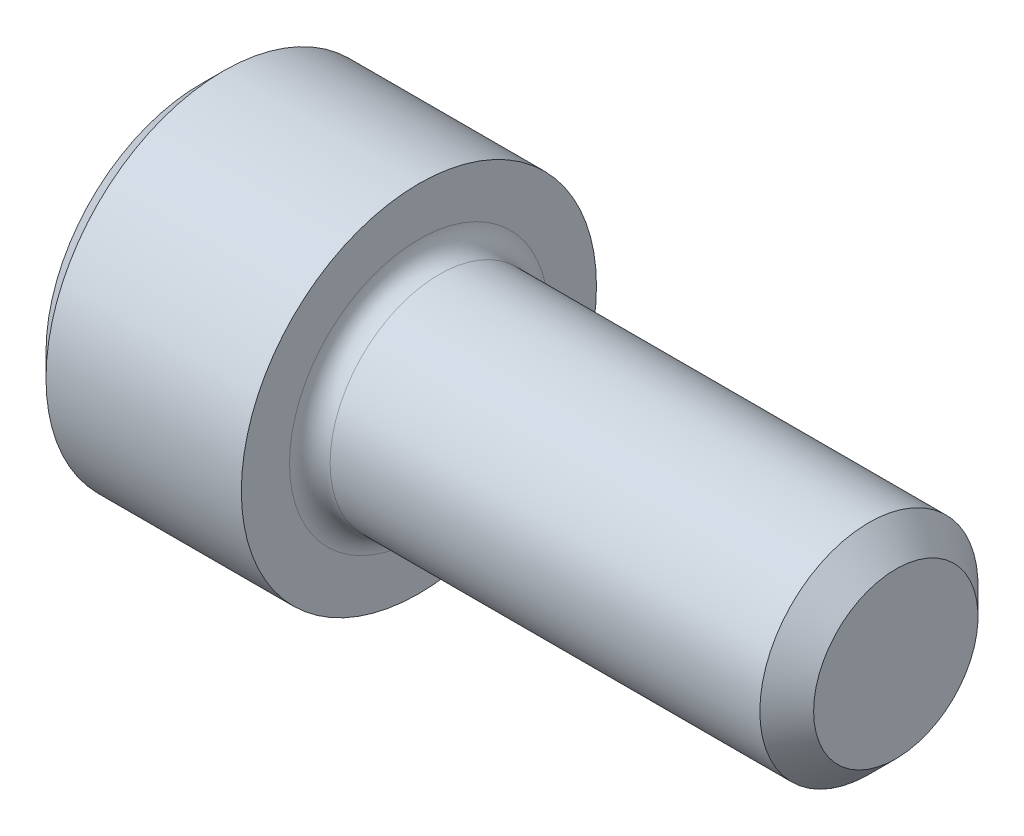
SolidWorks part; units mm, degrees
ref_plane "Plane1" through (0, 0, 0) normal (0, 0, 1) x (1, 0, 0)
ref_plane "Plane2" through (0, 0, 0) normal (0, 1, 0) x (1, 0, 0)
ref_plane "Plane3" through (0, 0, 0) normal (1, 0, 0) x (0, 0, -1)
revolve "Base-Revolve" add sketch "BodySke"
sketch "BodySke" plane through (0, 0, 0) normal (0, 0, 1) x (1, 0, 0)
  line L0 (0, 0) -> (0, 1.5494)
  line L1 (0.2286, 1.778) -> (2.1844, 1.778)
  line L2 (2.1844, 1.778) -> (2.1844, 1.0922)
  line L3 (2.1844, 1.0922) -> (6.6904, 1.0922)
  line L4 (6.9596, 0.823) -> (6.9596, 0)
  line L5 (6.9596, 0) -> (0, 0)
  line L6 (-31.75, 0) -> (127, 0) construction
  line L7 (0, 1.5494) -> (0.2286, 1.778)
  line L8 (6.9596, 0.823) -> (6.6904, 1.0922)
  line L9 (0, -1.5494) -> (0.2286, -1.778) construction
  line L10 (6.9596, -0.823) -> (6.6904, -1.0922) construction
  line L11 (2.6391, 9.525) -> (2.6391, 3.175) construction
  line L12 (2.1844, 9.525) -> (2.1844, 3.175) construction
  line L13 (-31.1404, 9.525) -> (-31.1404, 3.175) construction
  dimension "Diameter" = 2.1844
  dimension "Head_ht" = 2.1844
  dimension "Length" = 4.7752
  dimension "Body_ch_ang" = 45
  dimension "Head_dia" = 3.556
  dimension "Head_ch_ang" = 45
  dimension "Head_side_ht" = 1.9558
  dimension "Minor_dia" = 1.6459
  dimension "Advance" = 0.4547
  dimension "Thread_nom" = 4.7752
  dimension "Thread_length" = 38.1
fillet "Fillet1" radius 0.2032 1 edges at (2.1844, 0, 1.0922)
sketch "Sketch2" plane through (0, 0, 0) normal (0, 0, 1) x (1, 0, 0)
  line L0 (0, 0.9906) -> (0.9652, 0.9906)
  line L1 (0.9652, 0.9906) -> (1.5371, 0)
  line L2 (-31.75, 0) -> (127, 0) construction
  line L3 (1.5371, 0) -> (0, 0)
  line L4 (0, 0) -> (0, 0.9906)
  line L5 (0, 1.5494) -> (0, -1.5494) construction
  line L6 (0, 0) -> (47.625, 0) construction
  line L7 (2.1844, -1.778) -> (2.1844, 1.778) construction
  dimension "D1" = 0.9906
  dimension "D2" = 60
  dimension "Wall_thickness" = 1.2192
revolve "Hex-PreBroach" cut sketch "Sketch2" angle 360 about L6
sketch "Sketch3" plane through (0, 0, 0) normal (-1, 0, 0) x (0, 0.5, 0.866)
  line L0 (0.5719, 0.9906) -> (-0.5719, 0.9906)
  line L1 (-0.5719, 0.9906) -> (-1.1438, 0)
  line L2 (0.5719, 0.9906) -> (1.1438, 0)
  line L3 (0.5719, -0.9906) -> (1.1438, 0)
  line L4 (0.5719, -0.9906) -> (-0.5719, -0.9906)
  line L5 (-0.5719, -0.9906) -> (-1.1438, 0)
  dimension "D1" = 0.9906
  dimension "D2" = 0.9906
  dimension "Hex_size" = 1.9812
extrude "Hex" cut sketch "Sketch3" against normal blind 0.9652
sketch "Sketch4" plane through (0, 0, 0) normal (-1, 0, 0) x (0, 0, 1)
  line L0 (0, 0) -> (1.2446, 0)
  line L1 (0, 0) -> (6.1484, 3.5498) construction
  line L2 (0, 0) -> (0.6223, 1.0779)
  line L3 (1.0085, 0.2596) -> (1.19, 0.3644)
  line L4 (0.7291, 0.7436) -> (0.9106, 0.8484)
  arc A0 (1.0085, 0.2596) -> (0.7291, 0.7436) centre (0, 0) ccw
  arc A1 (1.2446, 0) -> (1.19, 0.3644) centre (0, 0) ccw
  arc A2 (0.6223, 1.0779) -> (0.9106, 0.8484) centre (0, 0) cw
  dimension "D1" = 30
  dimension "Spline_n_dim" = 2.0828
  dimension "Spline_m_dim" = 2.4892
  dimension "D2" = 60
  dimension "D3" = 0.2794
  dimension "Spline_p_dim" = 0.5588
extrude "Spline" [suppressed] cut sketch "Sketch4" against normal blind 0.9652
pattern_circular "CirPattern1" [suppressed] count 6 every 60
sketch "Sketch5" plane through (0, 0, 0) normal (0, 0, 1) x (1, 0, 0)
  line L0 (-31.75, 0) -> (127, 0) construction
  line L2 (0, 1.5494) -> (0, -1.5494) construction
  circle A0 centre (0.254, 0) radius 0.0127
  dimension "Drilled_hole_dia" = 0.0254
  dimension "Drilled_hole_loc" = 0.254
extrude "Hole" [suppressed] cut sketch "Sketch5" against normal through all and the other way through all
pattern_circular "Drilled-4" [suppressed] count 2 every 60
pattern_circular "Drilled-6" [suppressed] count 3 every 60
sketch "ThdSchSke" plane through (0, 0, 0) normal (0, 0, 1) x (1, 0, 0)
  line L0 (2.6391, -0.823) -> (2.4505, -1.0922)
  line L1 (2.6391, -0.823) -> (2.8276, -1.0922)
  line L2 (2.8276, -1.0922) -> (2.8276, -1.3653)
  line L3 (-3.175, 0) -> (5.1513, 0) construction
  line L5 (2.8276, -1.3653) -> (2.4505, -1.3653)
  line L6 (2.4505, -1.3653) -> (2.4505, -1.0922)
  line L7 (0, 1.5494) -> (0, -1.5494) construction
  dimension "Thread_minor" = 1.6459
  dimension "Diameter" = 2.1844
  dimension "Start" = 2.6391
  dimension "SideAngle" = 55
  dimension "VeeAngle" = 70
  dimension "Overcut" = 2.7305
revolve "ThreadSchematic" [suppressed] cut sketch "ThdSchSke" angle 360 about L3
pattern_linear "ThdSchPat" [suppressed]
equation "\"D2@Sketch3\" = \"Hex_size@Sketch3\" / 2"
equation "\"D1@Sketch3\" = \"Hex_size@Sketch3\" / 2"
equation "\"D1@Sketch2\" = \"Hex_size@Sketch3\" / 2"
equation "\"D3@Sketch4\" = \"Spline_p_dim@Sketch4\" / 2"
equation "\"Thread_minor@ThreadCosmetic\"  =  \"Minor_dia@BodySke\""
equation "\"D2@CirPattern1\" = 360 / \"Num_teeth@CirPattern1\""
equation "\"Wall_thickness@Sketch2\" = \"Head_ht@BodySke\" - \"Key_eng@Hex\""
equation "\"Thread_length@ThreadCosmetic\" = ((sgn( (\"Length@BodySke\" - \"Advance@BodySke\" ) - \"Thread_nom@BodySke\" )-1)*( (\"Length@BodySke\" - \"Advance@BodySke\" ) - \"Thread_nom@BodySke\" ))/-2+ \"Thread_nom@BodySke\""
equation "\"Thread_minor@ThdSchSke\" = \"Minor_dia@BodySke\""
equation "\"Diameter@ThdSchSke\" = \"Diameter@BodySke\""
equation "\"Overcut@ThdSchSke\" = \"Diameter@BodySke\" * 1.25"
equation "\"Start@ThdSchSke\" = \"Head_ht@BodySke\" + \"Length@BodySke\" - \"Thread_length@ThreadCosmetic\"  '---Non-countersunk---"
equation "\"Num_threads@ThdSchPat\" = int( \"Thread_length@ThreadCosmetic\" / \"Advance@BodySke\" + 0.999 )  + 1"
equation "\"Advance@ThdSchPat\" = \"Thread_length@ThreadCosmetic\" /  (\"Num_threads@ThdSchPat\" - 1) 'relax it"
equation "\"Num_threads@ThdSchPat\" = \"Num_threads@ThdSchPat\" - sgn( \"Num_threads@ThdSchPat\" - 1) '---chamfered tips only---"
